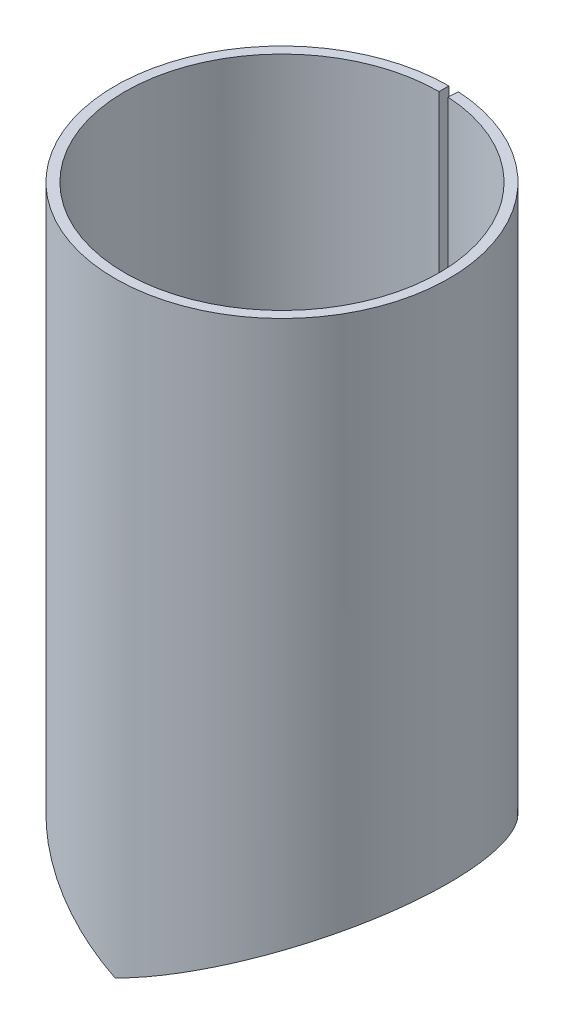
SolidWorks part; units mm, degrees
ref_plane "前视基准面" through (0, 0, 0) normal (0, 0, 1) x (1, 0, 0)
ref_plane "上视基准面" through (0, 0, 0) normal (0, 1, 0) x (1, 0, 0)
ref_plane "右视基准面" through (0, 0, 0) normal (1, 0, 0) x (0, 0, -1)
imported_body "基体零件-长短脚任意角度裤形三通管-1"
sheet metal parameters "钣金1" parameters "D1"=0.7366, "厚度"=1
bend "圆角折弯1" bend radius 15.9772 bend angle 356.623 parameters "D5"=1
flatten bends "展开-折弯1"
sketch "尖角-草图1" plane through (0, 30.8076, -16.9772) normal (0, 0, -1) x (-1, 0, 0)
  line L0 (49.723, 30.8076) -> (49.723, -30.5611) construction
  dimension "D1" = 0
process bends "加工-折弯1" parameters "D1"=0
sketch "平面-草图1" plane through (0, 30.8076, -16.9772) normal (0, 0, -1) x (-1, 0, 0)
